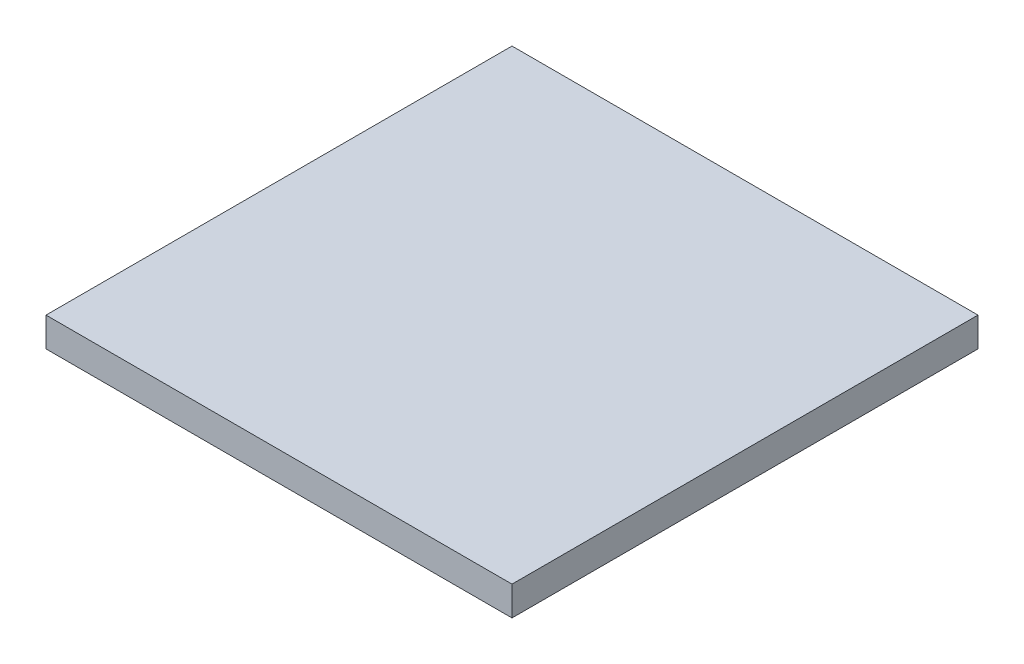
SolidWorks part; units mm, degrees
ref_plane "Front Plane" through (0, 0, 0) normal (0, 0, 1) x (1, 0, 0)
ref_plane "Top Plane" through (0, 0, 0) normal (0, 1, 0) x (1, 0, 0)
ref_plane "Right Plane" through (0, 0, 0) normal (1, 0, 0) x (0, 0, -1)
sketch "Sketch1" plane through (0, 0, 0) normal (0, 1, 0) x (1, 0, 0)
  line L1 (7.95, -7.95) -> (-7.95, -7.95)
  line L2 (7.95, -7.95) -> (7.95, 7.95)
  line L3 (7.95, 7.95) -> (-7.95, 7.95)
  line L4 (-7.95, -7.95) -> (-7.95, 7.95)
  line L5 (7.95, -7.95) -> (-7.95, 7.95) construction
  line L6 (7.95, 7.95) -> (-7.95, -7.95) construction
  point P0 (0, 0)
  dimension "D1" = 15.9
  dimension "D2" = 15.9
extrude "Boss-Extrude1" add sketch "Sketch1" along normal blind 1
